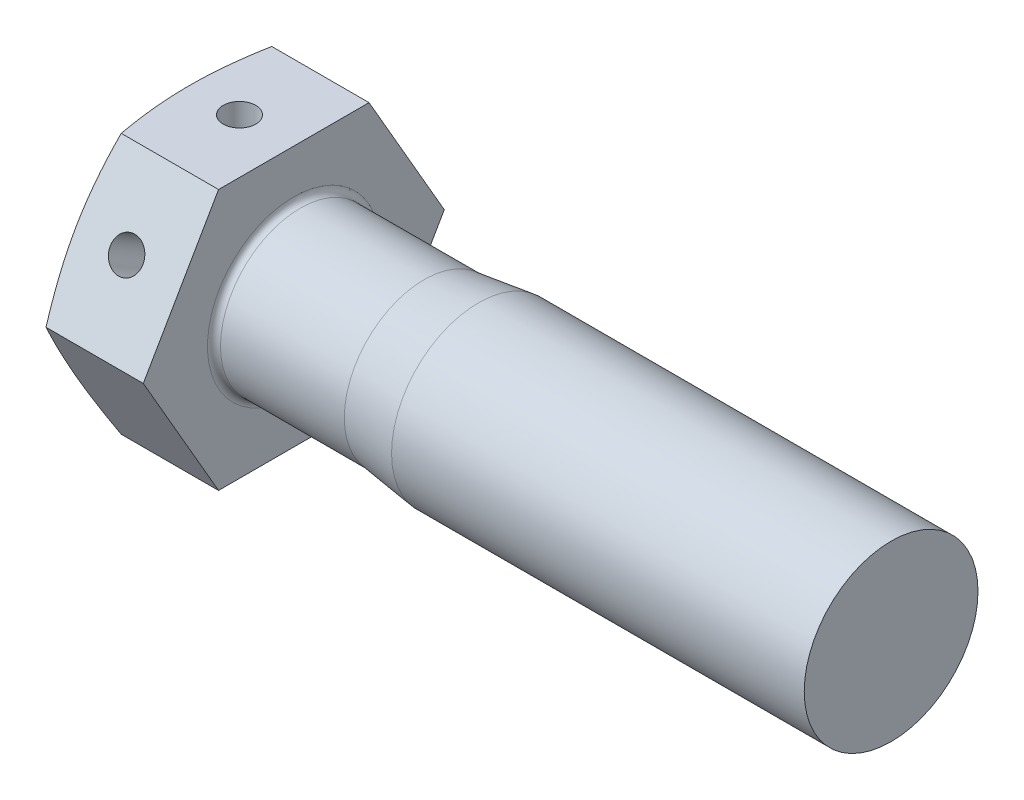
SolidWorks part; units mm, degrees
ref_plane "Front" through (0, 0, 0) normal (0, 0, 1) x (1, 0, 0)
ref_plane "Top" through (0, 0, 0) normal (0, 1, 0) x (1, 0, 0)
ref_plane "Right" through (0, 0, 0) normal (1, 0, 0) x (0, 0, -1)
sketch "Sketch1" plane through (0, 0, 0) normal (1, 0, 0) x (0, 0, -1)
  line L1 (13.8564, 0) -> (6.9282, 12)
  line L2 (6.9282, 12) -> (-6.9282, 12)
  line L3 (-6.9282, 12) -> (-13.8564, 0)
  line L4 (-13.8564, 0) -> (-6.9282, -12)
  line L5 (-6.9282, -12) -> (6.9282, -12)
  line L6 (6.9282, -12) -> (13.8564, 0)
  circle A0 centre (0, 0) radius 12 construction
  dimension "s" = 24
extrude "BaseHead" add sketch "Sketch1" along normal blind 10
ref_plane "Plane1" through (27, 0, 0) normal (1, 0, 0) x (0, 0, -1)
sketch "Sketch2" plane through (10, 0, 0) normal (1, 0, 0) x (0, 0, -1)
  circle A0 centre (0, 0) radius 8
  dimension "d" = 16
extrude "BaseBody" add sketch "Sketch2" along normal blind 55
sketch "Sketch3" plane through (3.1612, 0, 2.6123) normal (0, 1, 0) x (0, 0, -1)
  line L0 (2.6123, 5.2326) -> (2.6123, 1.6388) construction
  line L2 (16.4687, 3.1612) -> (16.4687, 2.1216)
  line L3 (16.4687, 2.1216) -> (13.6123, 3.1612)
  line L5 (13.6123, 3.1612) -> (16.4687, 3.1612)
  dimension "D1" = 20
  dimension "dw" = 22
revolve "HeadChamfer" cut sketch "Sketch3" angle 360 about L0
sketch "Sketch4" plane through (0, 0, 0) normal (-1, 0, 0) x (0, 0, 1)
  circle A0 centre (0, 0) radius 8.85
  dimension "da" = 17.7
extrude "Cut-Extrude1" cut sketch "Sketch4" against normal blind 2
sketch "Sketch5" plane through (-2.9296, 0, 7.9296) normal (0, 1, 0) x (0, 0, -1)
  line L0 (7.9296, -0.2325) -> (7.9296, -16.4861) construction
  line L1 (7.9296, -67.9296) -> (7.9296, -12.9296) construction
  line L2 (15.9296, -29.9296) -> (15.2801, -24.9296)
  line L3 (-0.0704, -67.9296) -> (15.9296, -67.9296) construction
  line L4 (15.2801, -24.9296) -> (15.2801, -12.9296)
  line L5 (15.9296, -67.9296) -> (15.9296, -12.9296) construction
  line L6 (15.2801, -12.9296) -> (22.6306, -12.9296)
  line L7 (22.6306, -12.9296) -> (22.6306, -29.9296)
  line L8 (22.6306, -29.9296) -> (15.9296, -29.9296)
  line L9 (21.786, -12.9296) -> (14.8578, -12.9296) construction
  dimension "ds" = 14.701
  dimension "x" = 5
  dimension "D3" = 38
  dimension "D4" = 29.402
revolve "Cut-Revolve1" cut sketch "Sketch5" angle 360 about L0
fillet "HeadFillet" radius 0.6 1 edges at (10, 0, 7.3505)
sketch "Sketch6" plane through (0, 0, 0) normal (0, 1, 0) x (1, 0, 0)
  line L0 (-2.6972, 0) -> (13.5564, 0) construction
  line L1 (10, 13.8564) -> (10, 6.9282) construction
  circle A0 centre (5, 0) radius 1.5
  dimension "d1" = 3
  dimension "h" = 5
extrude "Hole" cut sketch "Sketch6" against normal through all and the other way through all
pattern_circular "CirPattern1" count 2 over 60 about axis through (-2.6972, 0, 0) along (1, 0, 0) of "Hole"
equation "\"D1@Cut-Extrude1\" = 0.2 * \"k@BaseHead\""
equation "\"b@ThreadCosmetic1\" = \"l@BaseBody\" - \"lg@Plane1\""
equation "\"D4@Sketch5\" = 2 * \"ds@Sketch5\""
equation "\"D3@Sketch5\" =\"l@BaseBody\" - \"lg@Plane1\""
